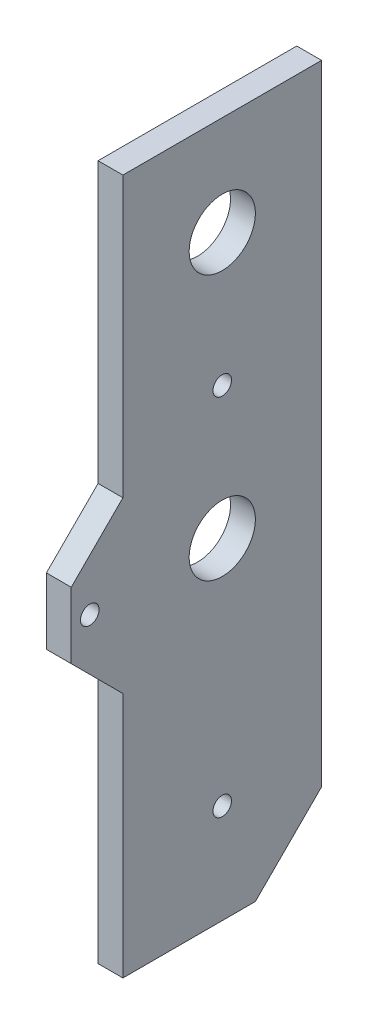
SolidWorks part; units mm, degrees
ref_plane "Front Plane" through (0, 0, 0) normal (0, 0, 1) x (1, 0, 0)
ref_plane "Top Plane" through (0, 0, 0) normal (0, 1, 0) x (1, 0, 0)
ref_plane "Right Plane" through (0, 0, 0) normal (1, 0, 0) x (0, 0, -1)
sketch "Sketch1" plane through (0, 0, 0) normal (1, 0, 0) x (0, 0, -1)
  line L10 (8.5726, -285.75) -> (8.5726, -16.256) construction
  line L15 (8.5726, 69.85) -> (46.6726, 69.85)
  line L17 (46.6726, 69.85) -> (46.6726, -50.8)
  line L21 (8.5726, -63.5) -> (33.9726, -63.5)
  line L24 (-1.3334, -6.35) -> (8.5726, -16.256) construction
  line L28 (8.5726, -63.5) -> (8.5726, -16.256)
  line L29 (-1.3334, -6.35) -> (8.5726, -16.256)
  line L33 (46.6726, -50.8) -> (33.9726, -63.5)
  line L34 (-1.3334, 6.35) -> (-1.3334, -6.35) construction
  line L35 (-1.3334, 6.35) -> (-1.3334, -6.35)
  line L40 (8.5726, 16.256) -> (-1.3334, 6.35) construction
  line L41 (8.5726, 69.85) -> (8.5726, 16.256) construction
  line L42 (8.5726, 16.256) -> (-1.3334, 6.35)
  line L43 (8.5726, 69.85) -> (8.5726, 16.256)
  circle A0 centre (27.6226, 0) radius 6.35
  circle A1 centre (27.6226, -25.4) radius 6.35 construction
  circle A2 centre (27.6226, 50.8) radius 6.35
  circle A4 centre (27.6226, -44.45) radius 1.778 construction
  circle A7 centre (27.6226, 25.4) radius 1.778 construction
  circle A8 centre (27.6226, -44.45) radius 1.778
  circle A12 centre (27.6226, 50.8) radius 6.35 construction
  circle A13 centre (27.6226, 0) radius 6.35 construction
  circle A14 centre (2.2226, 0) radius 1.778 construction
  circle A15 centre (2.2226, 0) radius 1.778
  circle A16 centre (27.6226, 25.4) radius 1.778
  dimension "D1" = 19.05
extrude "Boss-Extrude1" add sketch "Sketch1" along normal blind 4.7625
